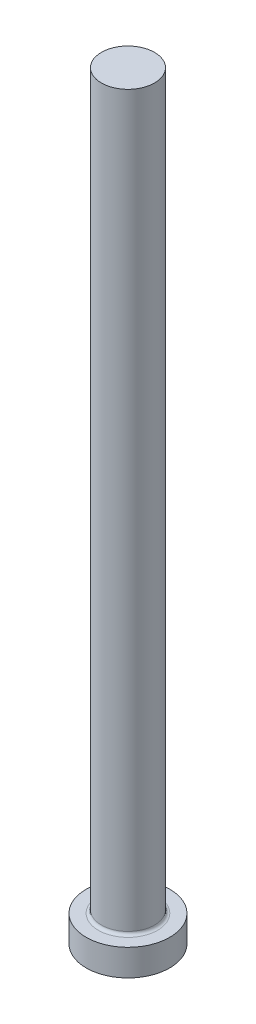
SolidWorks part; units mm, degrees
ref_plane "Plano frontal" through (0, 0, 0) normal (0, 0, 1) x (1, 0, 0)
ref_plane "Plano superior" through (0, 0, 0) normal (0, 1, 0) x (1, 0, 0)
ref_plane "Plano direito" through (0, 0, 0) normal (1, 0, 0) x (0, 0, -1)
sketch "Esboço1" plane through (0, 0, 0) normal (0, 0, 1) x (1, 0, 0)
  line L0 (0, 0) -> (11, 0)
  line L1 (11, 0) -> (11, 7)
  line L2 (11, 7) -> (7.8, 7)
  line L3 (7, 7.8) -> (7, 200)
  line L4 (7, 200) -> (0, 200)
  line L5 (0, 200) -> (0, 0) construction
  line L6 (0, 0) -> (0, 200)
  arc A0 (7.8, 7) -> (7, 7.8) centre (7.8, 7.8) cw
  dimension "D3" = 0.8
  dimension "D1" = 22
  dimension "D2" = 14
  dimension "D4" = 7
  dimension "D5" = 200
revolve "Revolução1" add sketch "Esboço1" angle 360 about L5
sketch "Esboço2"
  dimension "D1" = 0.825
  dimension "D2" = 1.925
  dimension "D3" = 1.2375
  dimension "D4" = 5.9125
wrap "Envolver1" sketch "Esboço2" wrap type deboss source sketch "Esboço2" thickness 0.1 parameters "D1"=0.1
